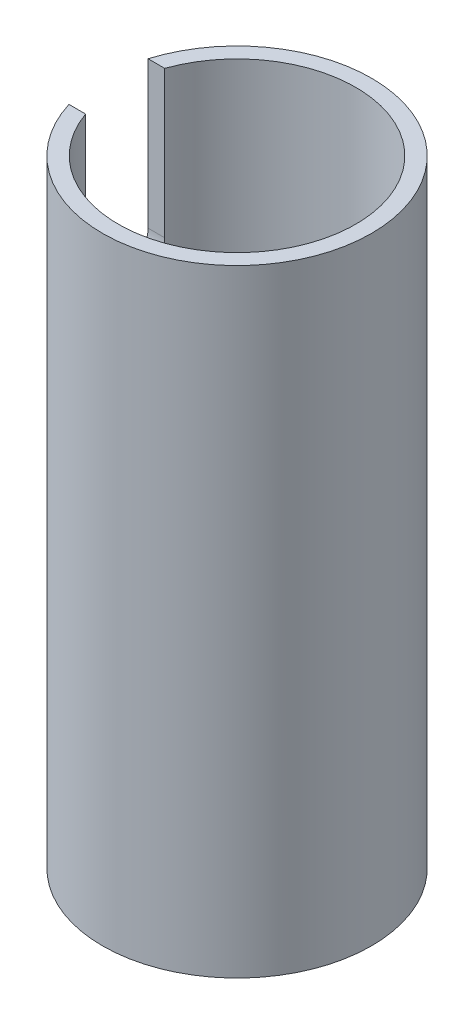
SolidWorks part; units mm, degrees
ref_plane "Plan de face" through (0, 0, 0) normal (0, 0, 1) x (1, 0, 0)
ref_plane "Plan de dessus" through (0, 0, 0) normal (0, 1, 0) x (1, 0, 0)
ref_plane "Plan de droite" through (0, 0, 0) normal (1, 0, 0) x (0, 0, -1)
sketch "Esquisse1" plane through (0, 0, 0) normal (0, 1, 0) x (1, 0, 0)
  circle A0 centre (0, 0) radius 7.5
  circle A1 centre (0, 0) radius 8.5
  dimension "D1" = 15
  dimension "D2" = 17
extrude "Boss.-Extru.1" add sketch "Esquisse1" along normal blind 39
sketch "Esquisse2" plane through (0, 0, 0) normal (1, 0, 0) x (0, 0, -1)
  line L0 (0, 42.9482) -> (0, 29.7249) construction
  line L1 (2.5, 42.9482) -> (2.5, 29.7249)
  line L2 (-2.5, 42.9482) -> (-2.5, 29.7249)
  arc A0 (2.5, 42.9482) -> (-2.5, 42.9482) centre (0, 42.9482) ccw
  arc A1 (-2.5, 29.7249) -> (2.5, 29.7249) centre (0, 29.7249) ccw
  point P3 (0, 36.3365)
  dimension "D1" = 5
  dimension "D2" = 13.2234
extrude "Enlèv. mat.-Extru.1" cut sketch "Esquisse2" against normal blind 10
